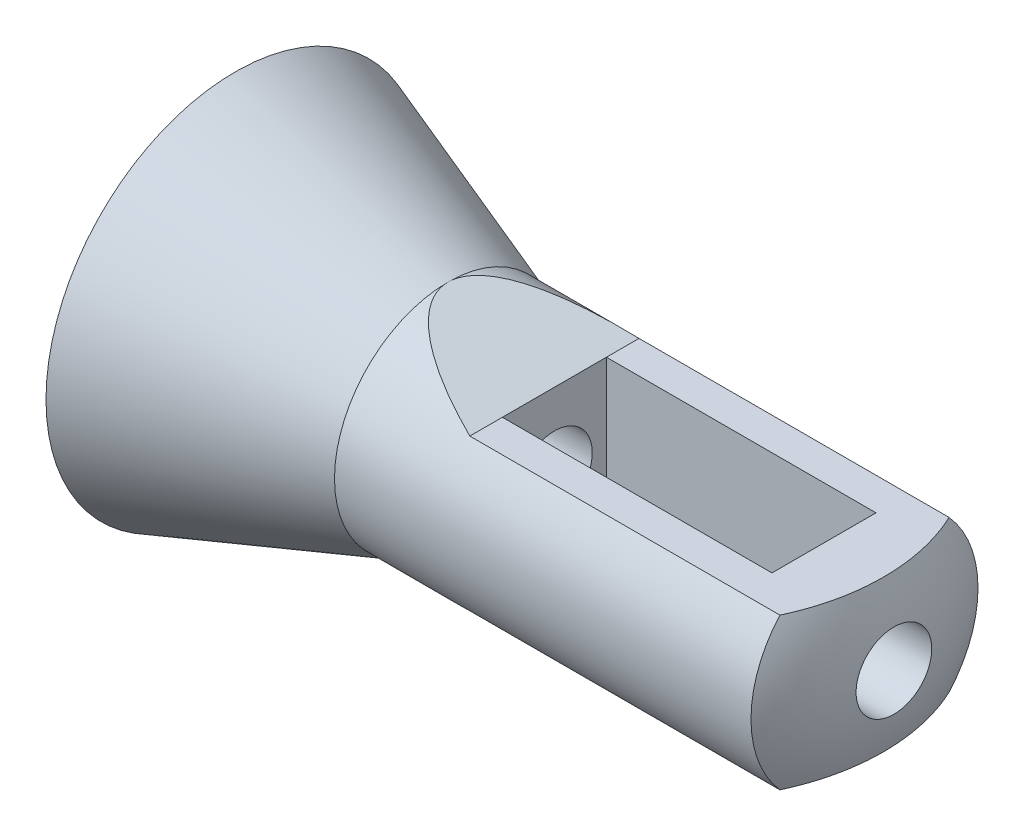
SolidWorks part; units mm, degrees
ref_plane "Front Plane" through (0, 0, 0) normal (0, 0, 1) x (1, 0, 0)
ref_plane "Top Plane" through (0, 0, 0) normal (0, 1, 0) x (1, 0, 0)
ref_plane "Right Plane" through (0, 0, 0) normal (1, 0, 0) x (0, 0, -1)
sketch "Sketch1" plane through (0, 0, 0) normal (0, 1, 0) x (1, 0, 0)
  line L0 (0, 0) -> (0, 40)
  line L1 (0, 40) -> (45, 24)
  line L2 (45, 24) -> (133.0657, 24)
  line L3 (0, 0) -> (140, 0) construction
  line L4 (0, 0) -> (140, 0)
  arc A0 (133.0657, 24) -> (140, 0) centre (95, 0) cw
  dimension "D4" = 45
  dimension "D1" = 80
  dimension "D2" = 48
  dimension "D3" = 140
  dimension "D5" = 45
revolve "Revolve1" add sketch "Sketch1" angle 360 about L3
shell "Shell1" thickness 16
sketch "Sketch2" plane through (0, 0, 0) normal (0, 0, 1) x (1, 0, 0)
  line L0 (45, 24) -> (0, 40) construction
  line L1 (67.5, 16) -> (0, 40)
  line L2 (67.5, 16) -> (137.0595, 16)
  line L3 (0, 0) -> (76.9127, 0) construction
  arc A0 (139.2832, 8) -> (133.0657, 24) centre (95, 0) ccw construction
  dimension "D1" = 32
extrude "Cut-Extrude1" cut sketch "Sketch2" against normal through all both and the other way through all
mirror "Mirror1" about plane through (0, 0, 0) normal (0, 1, 0) of "Cut-Extrude1"
sketch "Sketch3" plane through (0, 16, 0) normal (0, 1, 0) x (1, 0, 0)
  line L0 (67.5, -17.8885) -> (67.5, 17.8885) construction
  line L1 (67.5, 11) -> (124.5, 11)
  line L2 (67.5, 11) -> (67.5, -11)
  line L3 (67.5, -11) -> (124.5, -11)
  line L4 (124.5, 11) -> (124.5, -11)
  line L5 (0, 0) -> (67.5, 0) construction
  line L6 (0, 40) -> (0, -40) construction
  dimension "D1" = 57
  dimension "D2" = 22
extrude "Cut-Extrude2" cut sketch "Sketch3" against normal through all
